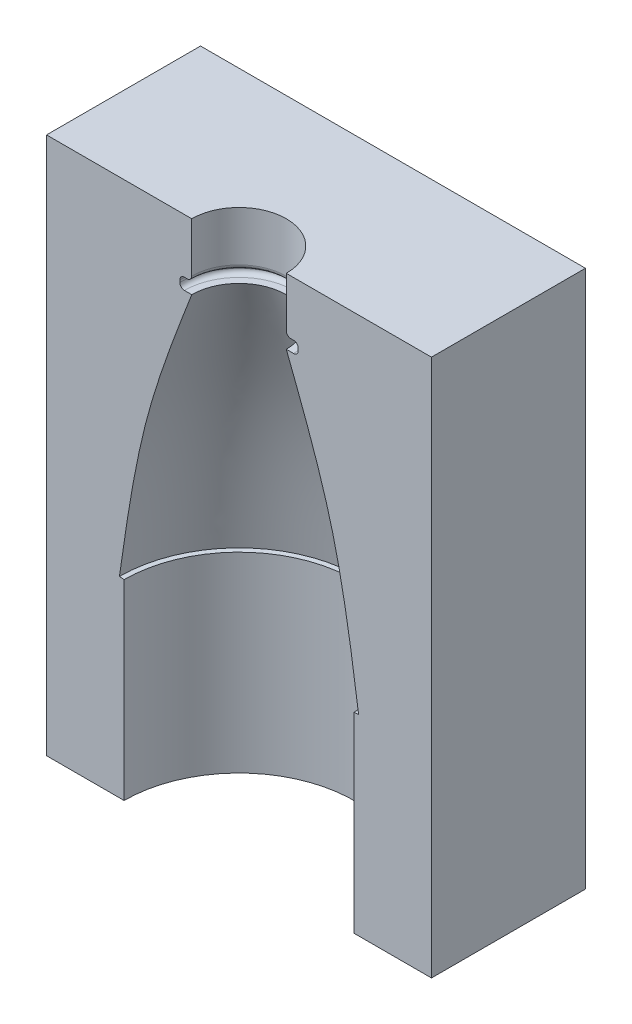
SolidWorks part; units mm, degrees
ref_plane "Front Plane" through (0, 0, 0) normal (0, 0, 1) x (1, 0, 0)
ref_plane "Top Plane" through (0, 0, 0) normal (0, 1, 0) x (1, 0, 0)
ref_plane "Right Plane" through (0, 0, 0) normal (1, 0, 0) x (0, 0, -1)
imported_body "Imported1"
sketch "Sketch1" plane through (0, 0, 0) normal (0, 0, 1) x (1, 0, 0)
  line L0 (12.2794, 66.9136) -> (-12.2794, 66.9136) construction
  line L1 (-50, -108.0864) -> (50, -108.0864)
  line L2 (-50, -108.0864) -> (-50, 66.9136)
  line L3 (-50, 66.9136) -> (50, 66.9136)
  line L4 (50, -108.0864) -> (50, 66.9136)
  line L5 (-50, -108.0864) -> (50, 66.9136) construction
  line L6 (-50, 66.9136) -> (50, -108.0864) construction
  point P0 (0, -20.5864)
  dimension "D1" = 175
  dimension "D2" = 100
extrude "Boss-Extrude1" add sketch "Sketch1" along normal mid plane 80 separate body
combine bodies "Combine3" operation type subtract main body 102 bodies to subtract 101
sketch "Sketch2" plane through (0, 66.9136, 0) normal (0, 1, 0) x (1, 0, 0)
  line L0 (-50, 0) -> (50, 0)
  line L1 (-50, -40) -> (-50, 40) construction
  line L2 (50, -40) -> (50, 40) construction
sketch "Sketch3" plane through (50, 0, 0) normal (1, 0, 0) x (0, 0, -1)
  line L0 (-40, -72.7693) -> (40, -72.7693)
  line L1 (-40, -108.0864) -> (-40, 66.9136) construction
  line L2 (-29.86, -72.7693) -> (29.86, -72.7693) construction
  line L4 (40, -108.0864) -> (40, 66.9136) construction
extrude "Cut-Extrude2" cut sketch "Sketch3" against normal through all and the other way through all flip side to cut
extrude "Cut-Extrude3" cut sketch "Sketch2" against normal through all and the other way through all flip side to cut
